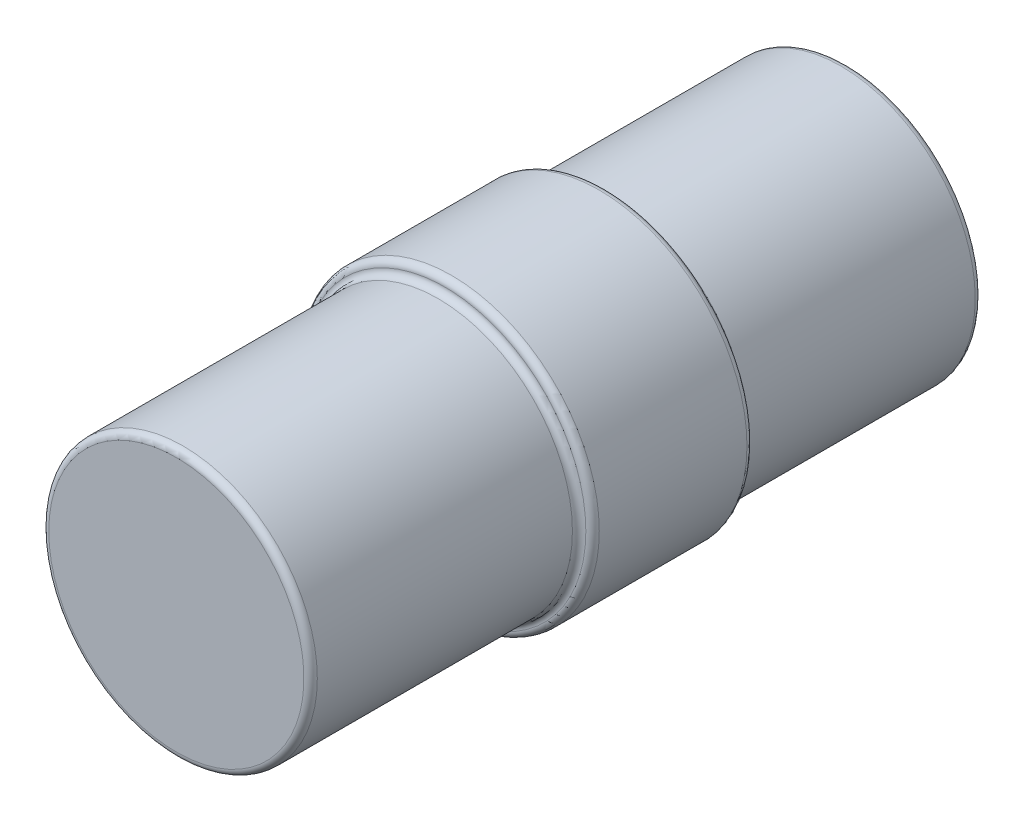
SolidWorks part; units mm, degrees
ref_plane "Спереди" through (0, 0, 0) normal (0, 0, 1) x (1, 0, 0)
ref_plane "Сверху" through (0, 0, 0) normal (0, 1, 0) x (1, 0, 0)
ref_plane "Справа" through (0, 0, 0) normal (1, 0, 0) x (0, 0, -1)
sketch "Эскиз1" plane through (0, 0, 0) normal (1, 0, 0) x (0, 0, -1)
  line L0 (0, 0) -> (50, 0)
  line L1 (50, 0) -> (50, 10)
  line L2 (50, 10) -> (32, 10)
  line L3 (32, 10) -> (32, 11)
  line L4 (32, 11) -> (20, 11)
  line L5 (20, 11) -> (20, 10)
  line L6 (20, 10) -> (0, 10)
  line L7 (0, 10) -> (0, 0)
  dimension "D1" = 10
  dimension "D2" = 11
  dimension "D3" = 20
  dimension "D4" = 12
  dimension "D5" = 18
revolve "Повернуть1" add sketch "Эскиз1" angle 360 about L0
fillet "Скругление1" radius 0.5 6 edges at (10, 0, -50) (10, 0, -32) (11, 0, -32) (11, 0, -20) (10, 0, -20) (10, 0, 0)
